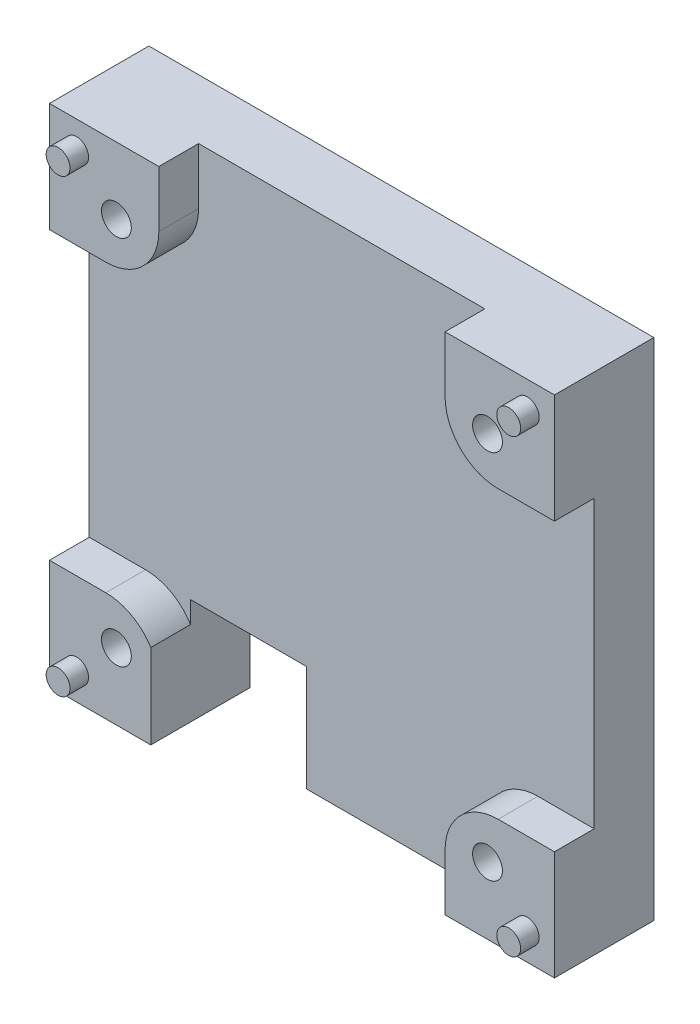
SolidWorks part; units mm, degrees
ref_plane "Front Plane" through (0, 0, 0) normal (0, 0, 1) x (1, 0, 0)
ref_plane "Top Plane" through (0, 0, 0) normal (0, 1, 0) x (1, 0, 0)
ref_plane "Right Plane" through (0, 0, 0) normal (1, 0, 0) x (0, 0, -1)
sketch "Sketch1" plane through (0, 0, 0) normal (0, 0, 1) x (1, 0, 0)
  line L0 (-8.5037, 11.5645) -> (9.4363, 11.5645) construction
  line L1 (-18.5837, -7.4855) -> (19.5163, -7.4855)
  line L2 (-18.5837, -7.4855) -> (-18.5837, 30.6145)
  line L3 (-18.5837, 30.6145) -> (19.5163, 30.6145)
  line L4 (19.5163, -7.4855) -> (19.5163, 30.6145)
  line L5 (-8.5037, 13.5645) -> (9.4363, 13.5645)
  line L6 (-8.5037, 9.5645) -> (9.4363, 9.5645)
  circle A0 centre (-13.5337, 25.5645) radius 1.4
  circle A1 centre (14.4663, 25.5645) radius 1.4
  circle A2 centre (17.4663, 28.5645) radius 1.3
  circle A3 centre (14.4663, -2.4355) radius 1.4
  circle A4 centre (17.4663, -5.4355) radius 1.3
  circle A5 centre (-13.5337, -2.4355) radius 1.4
  circle A6 centre (-16.5337, -5.4355) radius 1.3
  circle A7 centre (-16.5337, 28.5645) radius 1.3
  circle A8 centre (0.4663, 11.5645) radius 6.97
  arc A9 (-8.5037, 13.5645) -> (-8.5037, 9.5645) centre (-8.5037, 11.5645) ccw
  arc A10 (9.4363, 9.5645) -> (9.4363, 13.5645) centre (9.4363, 11.5645) ccw
  point P38 (0.4663, 11.5645)
sketch "Sketch3" plane through (0, 0, 0) normal (0, 0, 1) x (1, 0, 0)
  line L1 (-18.5837, 30.6145) -> (19.5163, 30.6145)
  line L2 (-18.5837, 30.6145) -> (-18.5837, -7.4855)
  line L3 (-18.5837, -7.4855) -> (19.5163, -7.4855)
  line L4 (19.5163, 30.6145) -> (19.5163, -7.4855)
  circle A0 centre (-13.5337, 25.5645) radius 1.125
  circle A1 centre (14.4663, 25.5645) radius 1.125
  circle A2 centre (14.4663, -2.4355) radius 1.125
  circle A3 centre (-13.5337, -2.4355) radius 1.125
  dimension "D1" = 2.25
extrude "Boss-Extrude1" add sketch "Sketch3" against normal blind 4.5
sketch "Sketch2" plane through (0, 0, 0) normal (0, 0, 1) x (1, 0, 0)
  line L1 (-18.5837, 30.6145) -> (-10.3337, 30.6145)
  line L2 (-18.5837, 30.6145) -> (-18.5837, 22.3645)
  line L3 (-18.5837, 22.3645) -> (-14.3337, 22.3645)
  line L4 (-10.3337, 30.6145) -> (-10.3337, 26.3645)
  line L5 (19.5163, 30.6145) -> (11.2663, 30.6145)
  line L6 (19.5163, 30.6145) -> (19.5163, 22.3645)
  line L7 (19.5163, 22.3645) -> (15.2663, 22.3645)
  line L8 (11.2663, 30.6145) -> (11.2663, 26.3645)
  line L9 (19.5163, -7.4855) -> (11.2663, -7.4855)
  line L10 (19.5163, -7.4855) -> (19.5163, 0.7645)
  line L11 (19.5163, 0.7645) -> (15.2663, 0.7645)
  line L12 (11.2663, -7.4855) -> (11.2663, -3.2355)
  line L13 (-18.5837, -7.4855) -> (-10.3337, -7.4855)
  line L14 (-18.5837, -7.4855) -> (-18.5837, 0.7645)
  line L15 (-18.5837, 0.7645) -> (-14.3337, 0.7645)
  line L16 (-10.3337, -7.4855) -> (-10.3337, -3.2355)
  arc A0 (-14.3337, 0.7645) -> (-10.3337, -3.2355) centre (-14.3337, -3.2355) cw
  arc A1 (15.2663, 0.7645) -> (11.2663, -3.2355) centre (15.2663, -3.2355) ccw
  arc A2 (15.2663, 22.3645) -> (11.2663, 26.3645) centre (15.2663, 26.3645) cw
  arc A3 (-14.3337, 22.3645) -> (-10.3337, 26.3645) centre (-14.3337, 26.3645) ccw
  circle A4 centre (-13.5337, 25.5645) radius 1.125
  circle A5 centre (14.4663, 25.5645) radius 1.125
  circle A6 centre (14.4663, -2.4355) radius 1.125
  circle A7 centre (-13.5337, -2.4355) radius 1.125
  dimension "D2" = 4
  dimension "D3" = 2.25
  dimension "D1" = 8.25
extrude "Boss-Extrude2" add sketch "Sketch2" along normal blind 3
sketch "Sketch4" plane through (0, 0, -4.5) normal (0, 0, -1) x (-1, 0, 0)
  line L0 (-0.4663, 11.5645) -> (-0.4663, 30.6145) construction
  line L7 (-0.4663, 30.6145) -> (-0.4663, 11.5645) construction
  line L8 (-0.4663, 11.5645) -> (18.5837, 11.5645) construction
  line L9 (18.5837, -7.4855) -> (18.5837, 30.6145) construction
  line L10 (18.5837, 30.6145) -> (-19.5163, 30.6145) construction
  line L12 (2.1887, 0.5145) -> (10.9387, 0.5145)
  line L13 (2.1887, 0.5145) -> (2.1887, -4.7355)
  line L14 (2.1887, -4.7355) -> (10.9387, -4.7355)
  line L15 (10.9387, 0.5145) -> (10.9387, -4.7355)
  line L17 (6.5637, 0.5145) -> (6.5637, -4.7355) construction
  line L18 (18.5837, -7.4855) -> (-19.5163, -7.4855) construction
  line L19 (10.9387, -2.1105) -> (6.5637, -2.1105) construction
  line L20 (6.5637, -2.1105) -> (2.1887, -2.1105) construction
  point P0 (-0.4663, 11.5645)
  dimension "D2" = 8.75
  dimension "D3" = 12.02
  dimension "D4" = 5.25
  dimension "D5" = 5.375
extrude "Cut-Extrude1" cut sketch "Sketch4" against normal blind 10
sketch "Sketch6" plane through (0, 0, -4.5) normal (0, 0, -1) x (-1, 0, 0)
  line L0 (18.5837, -7.4855) -> (-19.5163, -7.4855) construction
  line L1 (10.9387, -4.7355) -> (2.1887, -4.7355)
  line L2 (10.9387, -4.7355) -> (10.9387, -7.4855)
  line L3 (10.9387, -7.4855) -> (2.1887, -7.4855)
  line L4 (2.1887, -4.7355) -> (2.1887, -7.4855)
  line L5 (2.1887, 0.5145) -> (2.1887, -4.7355) construction
extrude "Cut-Extrude2" cut sketch "Sketch6" against normal blind 10
sketch "Sketch7" plane through (0, 0, 3) normal (0, 0, 1) x (1, 0, 0)
  circle A0 centre (-16.5337, 28.5645) radius 0.9
  circle A1 centre (17.4663, 28.5645) radius 0.9
  circle A2 centre (17.4663, -5.4355) radius 0.9
  circle A3 centre (-16.5337, -5.4355) radius 0.9
  dimension "D1" = 1.8
extrude "Boss-Extrude3" add sketch "Sketch7" along normal blind 1.4
